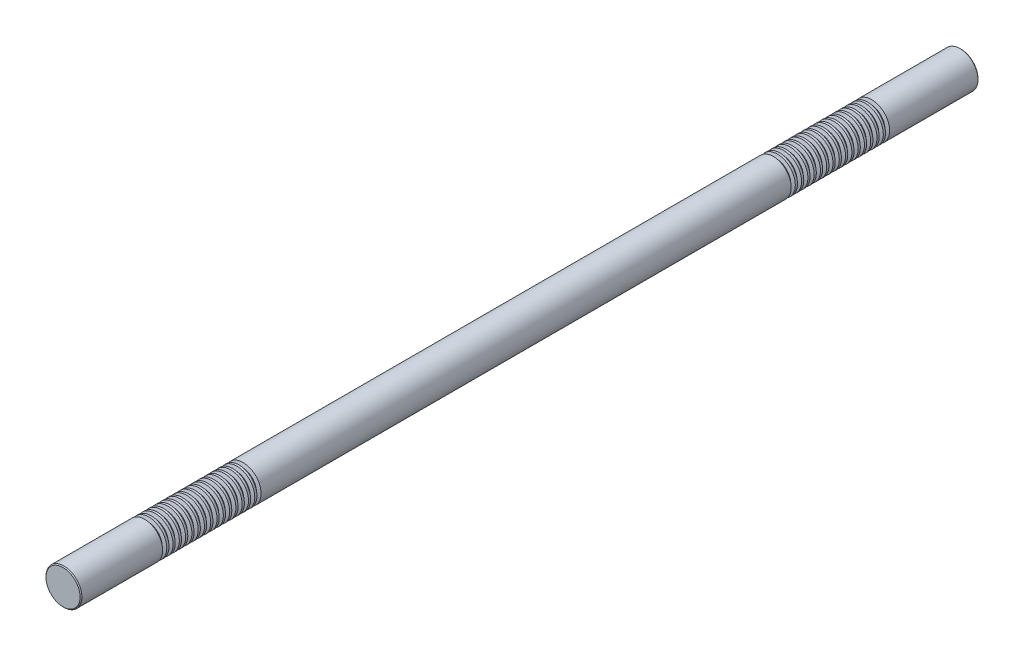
SolidWorks part; units mm, degrees
ref_plane "Front Plane" through (0, 0, 0) normal (0, 0, 1) x (1, 0, 0)
ref_plane "Top Plane" through (0, 0, 0) normal (0, 1, 0) x (1, 0, 0)
ref_plane "Right Plane" through (0, 0, 0) normal (1, 0, 0) x (0, 0, -1)
sketch "Sketch1" plane through (0, 0, 0) normal (0, 0, 1) x (1, 0, 0)
  circle A0 centre (0, 0) radius 20
  dimension "D1" = 40
extrude "Boss-Extrude1" add sketch "Sketch1" along normal mid plane 1000
chamfer "Chamfer1" distance 1 angle 45 2 edges at (20, 0, -500) (20, 0, 500)
sketch "Sketch2" plane through (0, 0, 0) normal (1, 0, 0) x (0, 0, -1)
  line L0 (400.5359, 20) -> (395.9641, 20)
  line L1 (499, 20) -> (-499, 20) construction
  line L2 (395.9641, 20) -> (397.0359, 16)
  line L3 (397.0359, 16) -> (399.4641, 16)
  line L4 (399.4641, 16) -> (400.5359, 20)
  line L5 (500, -19) -> (500, 19) construction
  point P4 (398.25, 20)
  point P7 (398.25, 16)
  point P8 (400, 18)
  point P9 (396.5, 18)
  dimension "D1" = 3.5
  dimension "D2" = 100
  dimension "D3" = 4
  dimension "D4" = 30
revolve "Cut-Revolve1" cut sketch "Sketch2" angle 360 about axis through (0, 0, 500) along (0, 0, -1)
pattern_linear "LPattern1" count 16 spacing 7 along (0, 0, 1) of "Cut-Revolve1"
pattern_linear "LPattern2" count 2 spacing 700 along (0, 0, 1) of "Cut-Revolve1", "LPattern1"
